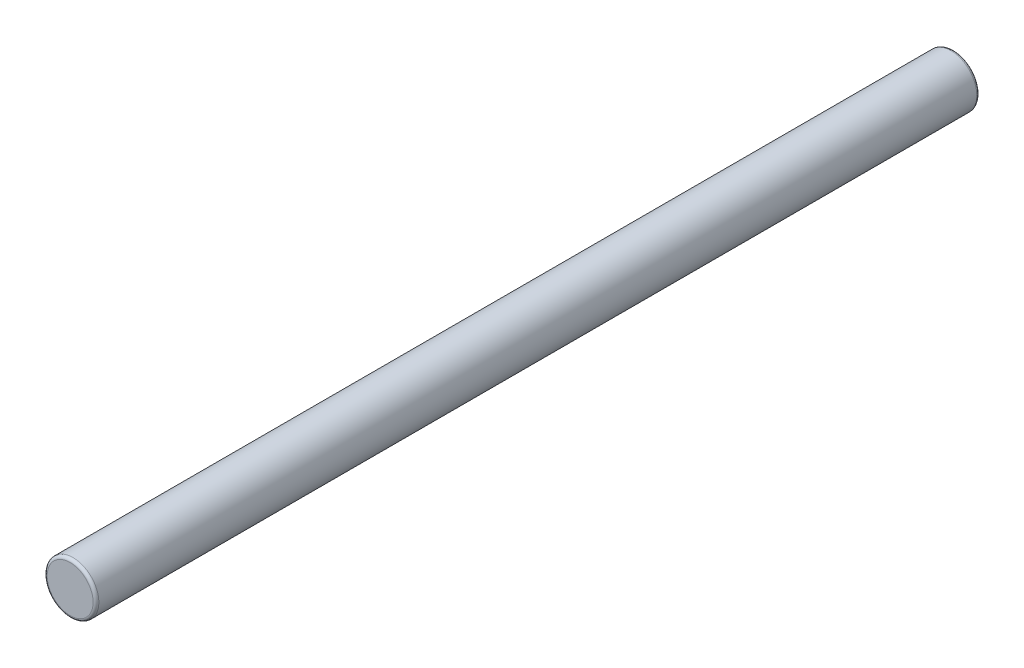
SolidWorks part; units mm, degrees
ref_plane "Piano frontale" through (0, 0, 0) normal (0, 0, 1) x (1, 0, 0)
ref_plane "Piano superiore" through (0, 0, 0) normal (0, 1, 0) x (1, 0, 0)
ref_plane "Piano destro" through (0, 0, 0) normal (1, 0, 0) x (0, 0, -1)
sketch "Schizzo1" plane through (0, 0, 0) normal (0, 0, 1) x (1, 0, 0)
  circle A0 centre (0, 0) radius 18
  dimension "D1" = 36
sketch "Schizzo2" plane through (0, 0, 0) normal (1, 0, 0) x (0, 0, -1)
  line L0 (0, 0) -> (615, 0)
  dimension "D1" = 615
sweep "Sweep1" add profiles "Schizzo1" path "Schizzo2"
sketch "Schizzo3" plane through (0, 0, -615) normal (0, 0, -1) x (-1, 0, 0)
  circle A0 centre (0, 0) radius 12
  circle A1 centre (0, 0) radius 18
  circle A2 centre (0, 0) radius 18 construction
  dimension "D1" = 24
extrude "Taglio-Estrusione1" [suppressed] cut sketch "Schizzo3" against normal blind 70
sketch "Schizzo5" plane through (0, 0, 0) normal (0, 0, 1) x (1, 0, 0)
  circle A1 centre (0, 0) radius 18
  circle A2 centre (0, 0) radius 18
  circle A3 centre (0, 0) radius 12
  circle A4 centre (0, 0) radius 12
  dimension "D1" = 0
  dimension "D2" = 0
extrude "Taglio-Estrusione2" [suppressed] cut sketch "Schizzo5" against normal blind 70
fillet "Raccordo1" radius 2 2 edges at (18, 0, 0) (18, 0, -615)
sketch "Linee di piegatura1" [suppressed] plane through (0, 0, 0) normal (0, 1, 0) x (1, 0, 0)
sketch "Casella di contorno1" [suppressed] plane through (0, 0, 0) normal (0, 1, 0) x (1, 0, 0)
equation "\"Lam_vern\"= 2 * ( \"SW-Massa\" / \"SW-Densità\" ) / ( \"Spessore\" / 1000 )"
